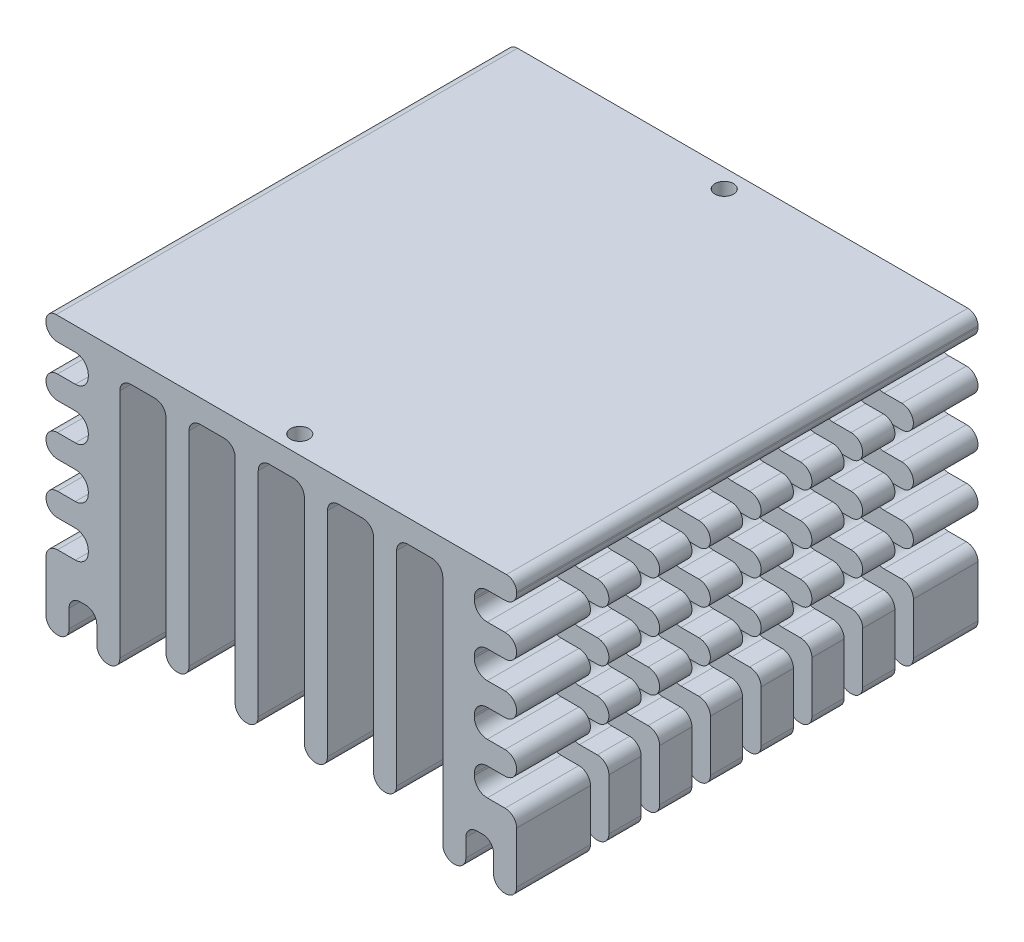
SolidWorks part; units mm, degrees
ref_plane "Face" through (0, 0, 0) normal (0, 0, 1) x (1, 0, 0)
ref_plane "Dessus" through (0, 0, 0) normal (0, 1, 0) x (1, 0, 0)
ref_plane "Droite" through (0, 0, 0) normal (1, 0, 0) x (0, 0, -1)
sketch "Esquisse1" plane through (0, 0, 0) normal (0, 0, 1) x (1, 0, 0)
  line L0 (6.247, 24.5) -> (4.3146, 24.5)
  line L1 (6.397, 27) -> (-42.403, 27)
  line L2 (-20.503, 0.2) -> (-20.503, 23.3)
  line L3 (6.297, -3) -> (6.197, -3)
  line L4 (7.497, 25.75) -> (7.497, 25.9)
  line L5 (2.9146, 23.1) -> (2.9146, 22.9)
  line L6 (4.3146, 21.5) -> (6.247, 21.5)
  line L7 (-18.003, 27) -> (-18.003, -3) construction
  line L8 (6.247, 19) -> (4.3146, 19)
  line L9 (2.9146, 17.6) -> (2.9146, 17.4)
  line L10 (4.3146, 16) -> (6.247, 16)
  line L11 (6.247, 13.5) -> (4.3146, 13.5)
  line L12 (2.9146, 12.1) -> (2.9146, 11.9)
  line L13 (4.3146, 10.5) -> (6.247, 10.5)
  line L14 (6.247, 8) -> (4.3146, 8)
  line L15 (2.9146, 6.6) -> (2.9146, 6.4)
  line L16 (4.3146, 5) -> (6.247, 5)
  line L17 (7.497, 3.75) -> (7.497, -1.8)
  line L18 (4.997, -1.8) -> (4.997, 0.1396)
  line L19 (3.797, 1.3396) -> (3.197, 1.3396)
  line L20 (1.997, 0.1396) -> (1.997, -1.8)
  line L21 (0.797, -3) -> (0.697, -3)
  line L22 (-0.503, -1.8) -> (-0.503, 23.3)
  line L23 (-1.703, 24.5) -> (-4.303, 24.5)
  line L24 (-5.503, 23.3) -> (-5.503, 1.2)
  line L25 (-6.703, 0) -> (-6.803, 0)
  line L26 (-8.003, 1.2) -> (-8.003, 23.3)
  line L27 (-9.203, 24.5) -> (-11.803, 24.5)
  line L28 (-13.003, 23.3) -> (-13.003, 0.2)
  line L29 (-14.203, -1) -> (-14.303, -1)
  line L30 (-15.503, 0.2) -> (-15.503, 23.3)
  line L31 (-16.703, 24.5) -> (-19.303, 24.5)
  line L32 (-21.803, -1) -> (-21.703, -1)
  line L33 (-23.003, 23.3) -> (-23.003, 0.2)
  line L34 (-26.803, 24.5) -> (-24.203, 24.5)
  line L35 (-28.003, 1.2) -> (-28.003, 23.3)
  line L36 (-29.303, 0) -> (-29.203, 0)
  line L37 (-30.503, 23.3) -> (-30.503, 1.2)
  line L38 (-34.303, 24.5) -> (-31.703, 24.5)
  line L39 (-35.503, -1.8) -> (-35.503, 23.3)
  line L40 (-36.803, -3) -> (-36.703, -3)
  line L41 (-38.003, 0.1396) -> (-38.003, -1.8)
  line L42 (-39.803, 1.3396) -> (-39.203, 1.3396)
  line L43 (-41.003, -1.8) -> (-41.003, 0.1396)
  line L44 (-43.503, 3.75) -> (-43.503, -1.8)
  line L45 (-40.3206, 5) -> (-42.253, 5)
  line L46 (-38.9206, 6.6) -> (-38.9206, 6.4)
  line L47 (-42.253, 8) -> (-40.3206, 8)
  line L48 (-40.3206, 10.5) -> (-42.253, 10.5)
  line L49 (-38.9206, 12.1) -> (-38.9206, 11.9)
  line L50 (-42.253, 13.5) -> (-40.3206, 13.5)
  line L51 (-40.3206, 16) -> (-42.253, 16)
  line L52 (-38.9206, 17.6) -> (-38.9206, 17.4)
  line L53 (-42.253, 19) -> (-40.3206, 19)
  line L54 (-40.3206, 21.5) -> (-42.253, 21.5)
  line L55 (-38.9206, 23.1) -> (-38.9206, 22.9)
  line L56 (-43.503, 25.75) -> (-43.503, 25.9)
  line L57 (-42.303, -3) -> (-42.203, -3)
  line L58 (-42.253, 24.5) -> (-40.3206, 24.5)
  arc A0 (4.3146, 24.5) -> (2.9146, 23.1) centre (4.3146, 23.1) ccw
  arc A1 (2.9146, 22.9) -> (4.3146, 21.5) centre (4.3146, 22.9) ccw
  arc A2 (6.247, 24.5) -> (7.497, 25.75) centre (6.247, 25.75) ccw
  arc A3 (6.247, 21.5) -> (7.497, 20.25) centre (6.247, 20.25) cw
  arc A4 (4.3146, 19) -> (2.9146, 17.6) centre (4.3146, 17.6) ccw
  arc A5 (2.9146, 17.4) -> (4.3146, 16) centre (4.3146, 17.4) ccw
  arc A6 (6.247, 19) -> (7.497, 20.25) centre (6.247, 20.25) ccw
  arc A7 (6.247, 16) -> (7.497, 14.75) centre (6.247, 14.75) cw
  arc A8 (4.3146, 13.5) -> (2.9146, 12.1) centre (4.3146, 12.1) ccw
  arc A9 (2.9146, 11.9) -> (4.3146, 10.5) centre (4.3146, 11.9) ccw
  arc A10 (6.247, 13.5) -> (7.497, 14.75) centre (6.247, 14.75) ccw
  arc A11 (6.247, 10.5) -> (7.497, 9.25) centre (6.247, 9.25) cw
  arc A12 (4.3146, 8) -> (2.9146, 6.6) centre (4.3146, 6.6) ccw
  arc A13 (2.9146, 6.4) -> (4.3146, 5) centre (4.3146, 6.4) ccw
  arc A14 (6.247, 8) -> (7.497, 9.25) centre (6.247, 9.25) ccw
  arc A15 (6.247, 5) -> (7.497, 3.75) centre (6.247, 3.75) cw
  arc A16 (6.397, 27) -> (7.497, 25.9) centre (6.397, 25.9) cw
  arc A17 (6.297, -3) -> (7.497, -1.8) centre (6.297, -1.8) ccw
  arc A18 (6.197, -3) -> (4.997, -1.8) centre (6.197, -1.8) cw
  arc A19 (1.997, -1.8) -> (0.797, -3) centre (0.797, -1.8) cw
  arc A20 (0.697, -3) -> (-0.503, -1.8) centre (0.697, -1.8) cw
  arc A21 (-5.503, 1.2) -> (-6.703, 0) centre (-6.703, 1.2) cw
  arc A22 (-6.803, 0) -> (-8.003, 1.2) centre (-6.803, 1.2) cw
  arc A23 (-13.003, 0.2) -> (-14.203, -1) centre (-14.203, 0.2) cw
  arc A24 (-14.303, -1) -> (-15.503, 0.2) centre (-14.303, 0.2) cw
  arc A25 (4.997, 0.1396) -> (3.797, 1.3396) centre (3.797, 0.1396) ccw
  arc A26 (3.197, 1.3396) -> (1.997, 0.1396) centre (3.197, 0.1396) ccw
  arc A27 (-0.503, 23.3) -> (-1.703, 24.5) centre (-1.703, 23.3) ccw
  arc A28 (-4.303, 24.5) -> (-5.503, 23.3) centre (-4.303, 23.3) ccw
  arc A29 (-8.003, 23.3) -> (-9.203, 24.5) centre (-9.203, 23.3) ccw
  arc A30 (-11.803, 24.5) -> (-13.003, 23.3) centre (-11.803, 23.3) ccw
  arc A31 (-15.503, 23.3) -> (-16.703, 24.5) centre (-16.703, 23.3) ccw
  arc A32 (-20.503, 23.3) -> (-19.303, 24.5) centre (-19.303, 23.3) cw
  arc A33 (-24.203, 24.5) -> (-23.003, 23.3) centre (-24.203, 23.3) cw
  arc A34 (-28.003, 23.3) -> (-26.803, 24.5) centre (-26.803, 23.3) cw
  arc A35 (-31.703, 24.5) -> (-30.503, 23.3) centre (-31.703, 23.3) cw
  arc A36 (-35.503, 23.3) -> (-34.303, 24.5) centre (-34.303, 23.3) cw
  arc A37 (-39.203, 1.3396) -> (-38.003, 0.1396) centre (-39.203, 0.1396) cw
  arc A38 (-41.003, 0.1396) -> (-39.803, 1.3396) centre (-39.803, 0.1396) cw
  arc A39 (-21.703, -1) -> (-20.503, 0.2) centre (-21.703, 0.2) ccw
  arc A40 (-23.003, 0.2) -> (-21.803, -1) centre (-21.803, 0.2) ccw
  arc A41 (-29.203, 0) -> (-28.003, 1.2) centre (-29.203, 1.2) ccw
  arc A42 (-30.503, 1.2) -> (-29.303, 0) centre (-29.303, 1.2) ccw
  arc A43 (-36.703, -3) -> (-35.503, -1.8) centre (-36.703, -1.8) ccw
  arc A44 (-38.003, -1.8) -> (-36.803, -3) centre (-36.803, -1.8) ccw
  arc A45 (-42.203, -3) -> (-41.003, -1.8) centre (-42.203, -1.8) ccw
  arc A46 (-42.303, -3) -> (-43.503, -1.8) centre (-42.303, -1.8) cw
  arc A47 (-42.403, 27) -> (-43.503, 25.9) centre (-42.403, 25.9) ccw
  arc A48 (-42.253, 5) -> (-43.503, 3.75) centre (-42.253, 3.75) ccw
  arc A49 (-42.253, 8) -> (-43.503, 9.25) centre (-42.253, 9.25) cw
  arc A50 (-38.9206, 6.4) -> (-40.3206, 5) centre (-40.3206, 6.4) cw
  arc A51 (-40.3206, 8) -> (-38.9206, 6.6) centre (-40.3206, 6.6) cw
  arc A52 (-42.253, 10.5) -> (-43.503, 9.25) centre (-42.253, 9.25) ccw
  arc A53 (-42.253, 13.5) -> (-43.503, 14.75) centre (-42.253, 14.75) cw
  arc A54 (-38.9206, 11.9) -> (-40.3206, 10.5) centre (-40.3206, 11.9) cw
  arc A55 (-40.3206, 13.5) -> (-38.9206, 12.1) centre (-40.3206, 12.1) cw
  arc A56 (-42.253, 16) -> (-43.503, 14.75) centre (-42.253, 14.75) ccw
  arc A57 (-42.253, 19) -> (-43.503, 20.25) centre (-42.253, 20.25) cw
  arc A58 (-38.9206, 17.4) -> (-40.3206, 16) centre (-40.3206, 17.4) cw
  arc A59 (-40.3206, 19) -> (-38.9206, 17.6) centre (-40.3206, 17.6) cw
  arc A60 (-42.253, 21.5) -> (-43.503, 20.25) centre (-42.253, 20.25) ccw
  arc A61 (-42.253, 24.5) -> (-43.503, 25.75) centre (-42.253, 25.75) cw
  arc A62 (-38.9206, 22.9) -> (-40.3206, 21.5) centre (-40.3206, 22.9) cw
  arc A63 (-40.3206, 24.5) -> (-38.9206, 23.1) centre (-40.3206, 23.1) cw
  point P17 (7.497, 24.5)
  point P188 (-18.003, 24.5)
  dimension "D5" = 1.4
  dimension "D7" = 1.25
  dimension "D1" = 1.1
  dimension "D2" = 1.2
  dimension "D4" = 3
  dimension "D13" = 25.5
  dimension "D14" = 30
  dimension "D15" = 27
  dimension "D16" = 28
  dimension "D17" = 2.5
extrude "Extrusion1" add sketch "Esquisse1" along normal blind 50
sketch "Esquisse2" plane through (0, 0, 0) normal (1, 0, 0) x (0, 0, -1)
  line L0 (-50, 24.5) -> (0, 24.5) construction
  line L1 (-42, 24.5) -> (-40, 24.5)
  line L2 (-42, 24.5) -> (-42, -6.2487)
  line L4 (-40, 24.5) -> (-40, -6.2487)
  line L5 (-50, 21.5) -> (-50, 19) construction
  line L6 (-36.5, 24.5) -> (-34.5, 24.5)
  line L7 (-36.5, 24.5) -> (-36.5, -6.2487)
  line L9 (-34.5, 24.5) -> (-34.5, -6.2487)
  line L10 (-31, 24.5) -> (-29, 24.5)
  line L11 (-31, 24.5) -> (-31, -6.2487)
  line L13 (-29, 24.5) -> (-29, -6.2487)
  line L14 (-25.5, 24.5) -> (-23.5, 24.5)
  line L15 (-25.5, 24.5) -> (-25.5, -6.2487)
  line L17 (-23.5, 24.5) -> (-23.5, -6.2487)
  line L18 (-20, 24.5) -> (-18, 24.5)
  line L19 (-20, 24.5) -> (-20, -6.2487)
  line L21 (-18, 24.5) -> (-18, -6.2487)
  line L22 (-14.5, 24.5) -> (-12.5, 24.5)
  line L23 (-14.5, 24.5) -> (-14.5, -6.2487)
  line L25 (-12.5, 24.5) -> (-12.5, -6.2487)
  line L26 (-9, 24.5) -> (-7, 24.5)
  line L27 (-9, 24.5) -> (-9, -6.2487)
  line L29 (-7, 24.5) -> (-7, -6.2487)
  line L31 (-42, -6.2487) -> (-42, -10.8109)
  line L32 (-42, -10.8109) -> (-7, -10.8109)
  line L33 (-7, -10.8109) -> (-7, -6.2487)
  line L34 (-9, -6.2487) -> (-12.5, -6.2487)
  line L35 (-14.5, -6.2487) -> (-18, -6.2487)
  line L36 (-20, -6.2487) -> (-23.5, -6.2487)
  line L37 (-25.5, -6.2487) -> (-29, -6.2487)
  line L38 (-31, -6.2487) -> (-34.5, -6.2487)
  line L39 (-36.5, -6.2487) -> (-40, -6.2487)
  line L41 (-9, -6.2487) -> (-7, -6.2487)
  line L42 (-14.5, -6.2487) -> (-12.5, -6.2487)
  line L43 (-20, -6.2487) -> (-18, -6.2487)
  line L44 (-25.5, -6.2487) -> (-23.5, -6.2487)
  line L45 (-31, -6.2487) -> (-29, -6.2487)
  line L46 (-36.5, -6.2487) -> (-34.5, -6.2487)
  line L47 (-42, -6.2487) -> (-40, -6.2487)
  dimension "D1" = 8
  dimension "D2" = 2
extrude "Enlèv. mat.-Extru.1" cut sketch "Esquisse2" against normal blind 50 and the other way blind 50
sketch "Esquisse3" plane through (0, 24.5, 0) normal (0, -1, 0) x (1, 0, 0)
  line L0 (-19.303, 50) -> (-16.703, 50) construction
  line L1 (-19.303, 0) -> (-16.703, 0) construction
  circle A0 centre (-18.003, 48) radius 1
  circle A1 centre (-18.003, 2) radius 1
  point P2 (-18.003, 50)
  point P7 (-18.003, 0)
  dimension "D1" = 2
  dimension "D2" = 2
extrude "Enlèv. mat.-Extru.2" cut sketch "Esquisse3" against normal blind 50
